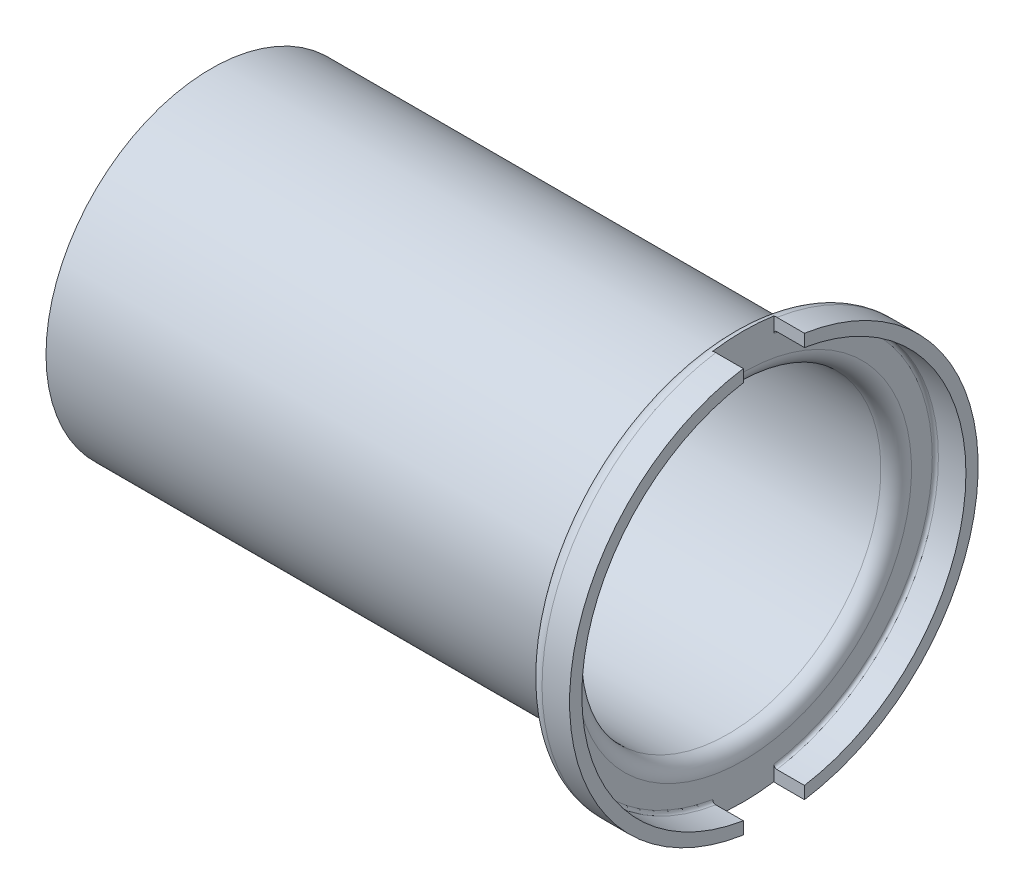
SolidWorks part; units mm, degrees
ref_plane "Plan1" through (0, 0, 0) normal (0, 0, 1) x (1, 0, 0)
ref_plane "Plan2" through (0, 0, 0) normal (0, 1, 0) x (1, 0, 0)
ref_plane "Plan3" through (0, 0, 0) normal (1, 0, 0) x (0, 0, -1)
sketch "Esquisse1" plane through (0, 0, 0) normal (0, 0, 1) x (1, 0, 0)
  line L0 (0, 27) -> (84.5, 27)
  line L1 (85, 27.5) -> (85, 30.9)
  line L2 (87.5, 33.4) -> (92, 33.4)
  line L3 (0, 0) -> (100, 0) construction
  arc A0 (87.5, 33.4) -> (85, 30.9) centre (87.5, 30.9) ccw
  arc A1 (85, 27.5) -> (84.5, 27) centre (84.5, 27.5) cw
  point P9 (85, 33.4)
  dimension "D5" = 2.5
  dimension "D6" = 0.5
  dimension "D1" = 27
  dimension "D2" = 33.4
  dimension "D3" = 7
  dimension "D4" = 92
revolve "Base-Révol.-Mince" add sketch "Esquisse1" angle 360 about L3
sketch "Esquisse2" plane through (0, 0, 0) normal (0, 1, 0) x (1, 0, 0)
  line L0 (92, -33.4) -> (92, 33.4) construction
  line L1 (92, -5) -> (87, -5)
  line L2 (92, -5) -> (92, 5)
  line L3 (92, 5) -> (87, 5)
  line L4 (87, -5) -> (87, 5)
  line L6 (87, -27.5) -> (87, 27.5) construction
  point P8 (92, 0)
  dimension "D1" = 10
extrude "Enlèv. mat.-Extru.1" cut sketch "Esquisse2" against normal through all and the other way through all
